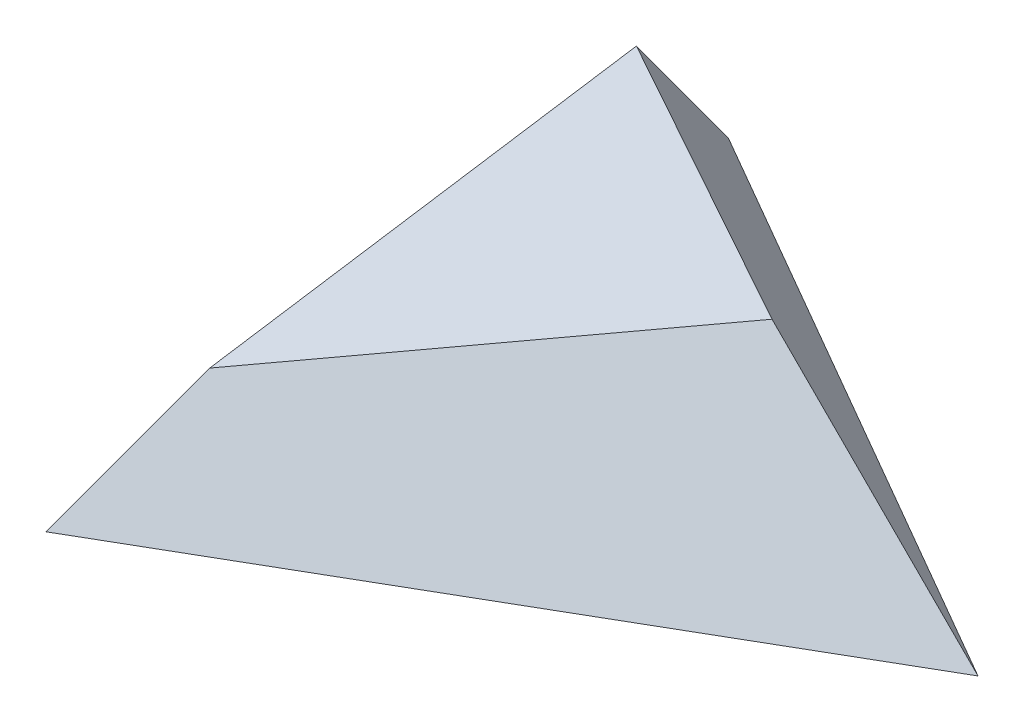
SolidWorks part; units mm, degrees
ref_plane "前视基准面" through (0, 0, 0) normal (0, 0, 1) x (1, 0, 0)
ref_plane "上视基准面" through (0, 0, 0) normal (0, 1, 0) x (1, 0, 0)
ref_plane "右视基准面" through (0, 0, 0) normal (1, 0, 0) x (0, 0, -1)
sketch "草图1" plane through (0, 0, 0) normal (0, 1, 0) x (1, 0, 0)
  line L4 (60, 0) -> (-30, 51.9615)
  line L5 (-30, 51.9615) -> (-30, -51.9615)
  line L6 (-30, -51.9615) -> (60, 0)
  circle A0 centre (0, 0) radius 30 construction
  dimension "D1" = 60
sketch "草图3" plane through (0, 0, 0) normal (0, 0, 1) x (1, 0, 0)
  line L0 (0, 60) -> (0, 0)
  point P0 (0, 60)
  dimension "D1" = 60
loft "放样1" add profiles "草图3", "草图1"
sketch "草图5" plane through (0, 0, 0) normal (1, 0, 0) x (0, 0, -1)
  line L0 (-36.1527, 18.2545) -> (18.8637, 38.2181)
  line L1 (0, 60) -> (-51.9615, 0) construction
  line L2 (0, 60) -> (51.9615, 0) construction
  line L3 (18.8637, 38.2181) -> (21.1521, 70.1345)
  line L4 (21.1521, 70.1345) -> (-42.7314, 68.2116)
  line L5 (-42.7314, 68.2116) -> (-36.1527, 18.2545)
  point P6 (18.8637, 38.2181)
extrude "切除-拉伸1" cut sketch "草图5" against normal through all both and the other way through all
